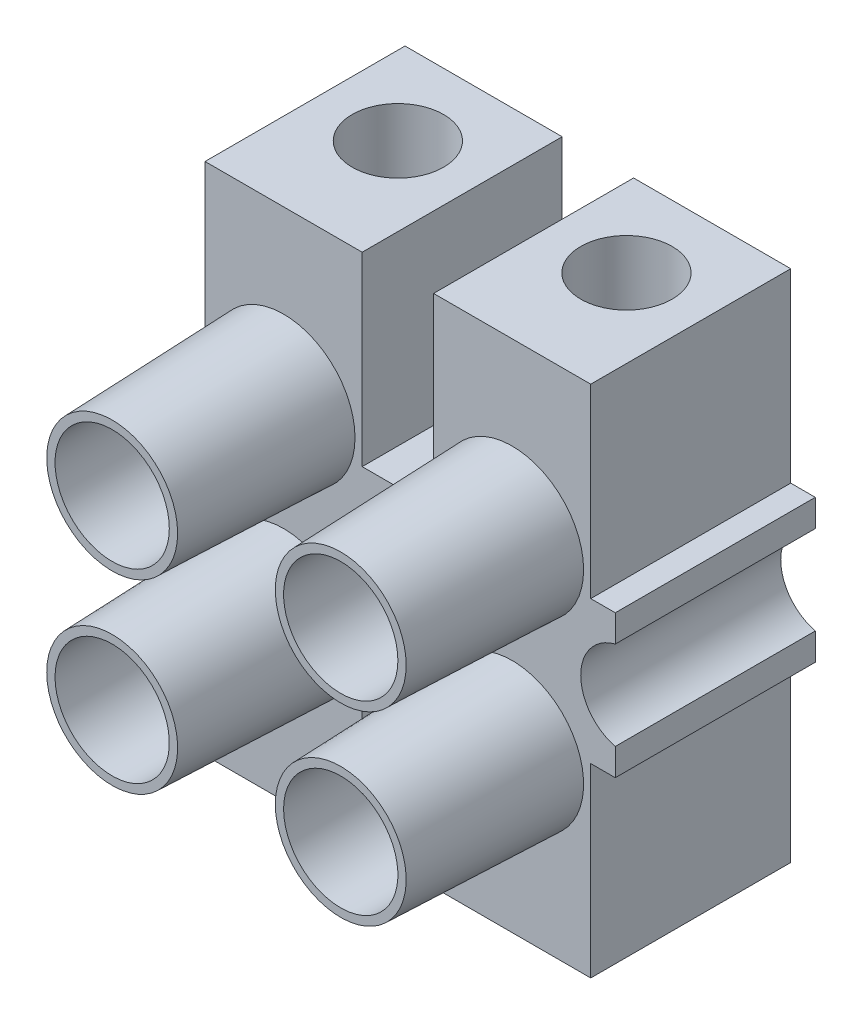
SolidWorks part; units mm, degrees
ref_plane "Face" through (0, 0, 0) normal (0, 0, 1) x (1, 0, 0)
ref_plane "Dessus" through (0, 0, 0) normal (0, 1, 0) x (1, 0, 0)
ref_plane "Droite" through (0, 0, 0) normal (1, 0, 0) x (0, 0, -1)
sketch "Esquisse1" plane through (0, 0, 0) normal (0, 0, 1) x (1, 0, 0)
  line L0 (-4.9042, 0) -> (59.2709, 0) construction
  line L1 (0, 20.3118) -> (0, -20.4548) construction
  line L2 (5.5, 22.3143) -> (5.5, 1.1443) construction
  line L3 (8, 16.8788) -> (8, 1.1443) construction
  line L4 (-3.3916, 9) -> (17.4208, 9) construction
  line L5 (-1.7466, 2.5) -> (11.2701, 2.5) construction
  line L6 (0, 2.5) -> (0, 9)
  line L7 (0, 9) -> (5.5, 9)
  line L8 (5.5, 9) -> (5.5, 2.5)
  line L9 (5.5, 2.5) -> (8, 2.5)
  line L10 (13.5, 2.5) -> (14.3588, 2.5)
  line L11 (13.5, 9) -> (13.5, 2.5)
  line L12 (8, 9) -> (13.5, 9)
  line L13 (8, 2.5) -> (8, 9)
  line L14 (14.3588, 2.5) -> (14.3588, 1.5514)
  line L15 (14.3588, -1.5514) -> (14.3588, -2.5)
  line L26 (37.5, 2.5) -> (40, 2.5)
  line L27 (0, 2.5) -> (0, -2.5)
  line L39 (8, -2.5) -> (8, -9)
  line L40 (8, -9) -> (13.5, -9)
  line L41 (13.5, -9) -> (13.5, -2.5)
  line L42 (13.5, -2.5) -> (14.3588, -2.5)
  line L43 (5.5, -2.5) -> (8, -2.5)
  line L44 (5.5, -9) -> (5.5, -2.5)
  line L45 (0, -9) -> (5.5, -9)
  line L46 (0, -2.5) -> (0, -9)
  line L47 (37.5, 9) -> (37.5, 2.5)
  line L48 (29.5, 2.5) -> (32, 2.5)
  line L49 (32, 9) -> (37.5, 9)
  line L50 (32, 2.5) -> (32, 9)
  line L51 (24, 9) -> (29.5, 9)
  line L52 (24, 2.5) -> (24, 9)
  line L53 (21.5, 9) -> (21.5, 2.5)
  line L54 (21.5, 2.5) -> (24, 2.5)
  line L55 (16, 9) -> (21.5, 9)
  line L56 (29.5, 9) -> (29.5, 2.5)
  line L57 (16, 2.5) -> (16, 9)
  circle A0 centre (6.75, 0) radius 1.6
  arc A1 (14.3588, 1.5514) -> (14.3588, -1.5514) centre (14.75, 0) ccw
  circle A4 centre (30.75, 0) radius 1.6
  circle A5 centre (22.75, 0) radius 1.6
  point P34 (0, 0)
  point P41 (37.5, 0)
extrude "Base-Extrusion" add sketch "Esquisse1" along normal blind 7
sketch "Esquisse2" plane through (0, 0, 7) normal (0, 0, 1) x (1, 0, 0)
  line L0 (-1.4565, 0) -> (37.8699, 0) construction
  circle A0 centre (2.75, 3.25) radius 2.5
  circle A1 centre (2.75, 3.25) radius 2
  circle A2 centre (10.75, 3.25) radius 2.5
  circle A3 centre (10.75, 3.25) radius 2
  circle A16 centre (10.75, -3.25) radius 2
  circle A17 centre (10.75, -3.25) radius 2.5
  circle A18 centre (2.75, -3.25) radius 2
  circle A19 centre (2.75, -3.25) radius 2.5
  circle A20 centre (34.75, 3.25) radius 2.5
  circle A21 centre (34.75, 3.25) radius 2
  circle A22 centre (26.75, 3.25) radius 2.5
  circle A23 centre (26.75, 3.25) radius 2
  circle A24 centre (18.75, 3.25) radius 2.5
  circle A25 centre (18.75, 3.25) radius 2
extrude "Boss.-Extru.1" add sketch "Esquisse2" along normal blind 6
sketch "Esquisse3" plane through (0, -9, 0) normal (0, -1, 0) x (1, 0, 0)
  circle A0 centre (2.75, 3) radius 1.6
  circle A1 centre (10.75, 3) radius 1.6
  circle A2 centre (18.75, 3) radius 1.6
  circle A3 centre (26.75, 3) radius 1.6
  circle A4 centre (34.75, 3) radius 1.6
extrude "Enlèv. mat.-Extru.1" cut sketch "Esquisse3" against normal through all
draft "Dépouille1" type of draft neutral plane draft angle 2 faces to draft 4 parameters "D1"=2
